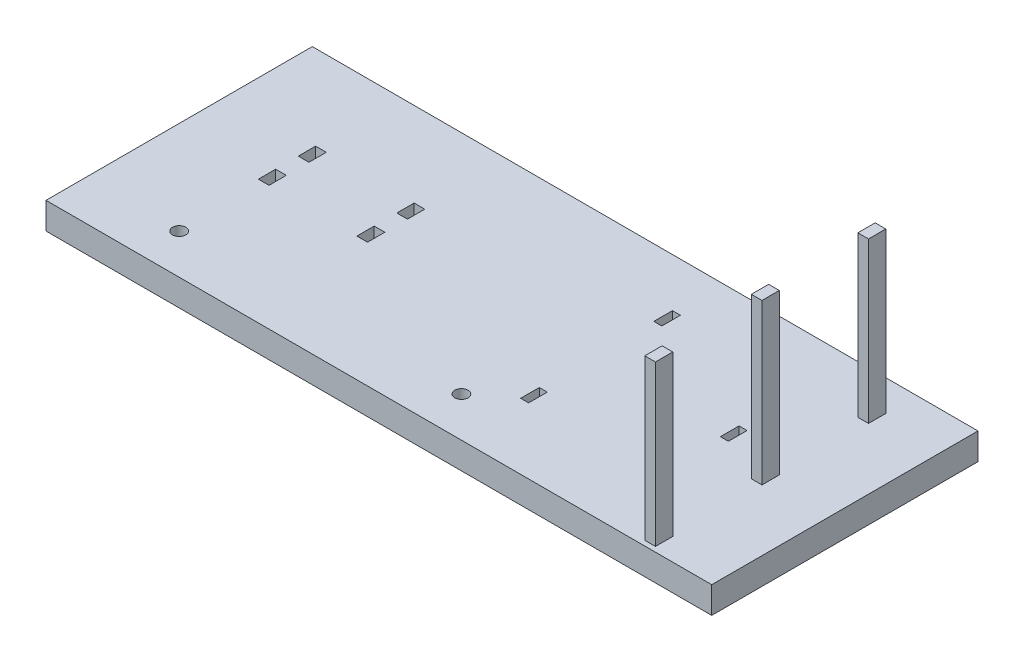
SolidWorks part; units mm, degrees
ref_plane "Front Plane" through (0, 0, 0) normal (0, 0, 1) x (1, 0, 0)
ref_plane "Top Plane" through (0, 0, 0) normal (0, 1, 0) x (1, 0, 0)
ref_plane "Right Plane" through (0, 0, 0) normal (1, 0, 0) x (0, 0, -1)
sketch "Sketch1" plane through (0, 0, 0) normal (0, 1, 0) x (1, 0, 0)
  line L1 (-12.5, -5) -> (12.5, -5)
  line L2 (-12.5, -5) -> (-12.5, 5)
  line L3 (-12.5, 5) -> (12.5, 5)
  line L4 (12.5, -5) -> (12.5, 5)
  line L5 (-12.5, -5) -> (12.5, 5) construction
  line L6 (-12.5, 5) -> (12.5, -5) construction
  point P0 (0, 0)
  dimension "D1" = 10
  dimension "D2" = 25
extrude "Boss-Extrude1" add sketch "Sketch1" along normal blind 1
sketch "Sketch2" plane through (0, 0, 0) normal (0, -1, 0) x (1, 0, 0)
  line L0 (-12.5, 0) -> (12.5, 0) construction
  line L1 (-9.2, -0.325) -> (-8.8, -0.325)
  line L2 (-9.2, -0.325) -> (-9.2, 0.325)
  line L3 (-9.2, 0.325) -> (-8.8, 0.325)
  line L4 (-8.8, -0.325) -> (-8.8, 0.325)
  line L5 (-9.2, -0.325) -> (-8.8, 0.325) construction
  line L6 (-9.2, 0.325) -> (-8.8, -0.325) construction
  line L7 (-9.2, -1.825) -> (-8.8, -1.825)
  line L8 (-9.2, -1.825) -> (-9.2, -1.175)
  line L9 (-9.2, -1.175) -> (-8.8, -1.175)
  line L10 (-8.8, -1.825) -> (-8.8, -1.175)
  line L11 (-9.2, -1.825) -> (-8.8, -1.175) construction
  line L12 (-9.2, -1.175) -> (-8.8, -1.825) construction
  line L13 (-12.5, -5) -> (-12.5, 5) construction
  line L14 (12.5, 5) -> (12.5, -5) construction
  line L15 (-5.5, 0.325) -> (-5.1, 0.325)
  line L16 (-5.5, -0.325) -> (-5.5, 0.325)
  line L17 (-5.5, -0.325) -> (-5.1, -0.325)
  line L18 (-5.1, -0.325) -> (-5.1, 0.325)
  line L19 (-5.5, -1.175) -> (-5.1, -1.175)
  line L20 (-5.5, -1.825) -> (-5.5, -1.175)
  line L21 (-5.5, -1.825) -> (-5.1, -1.825)
  line L22 (-5.1, -1.825) -> (-5.1, -1.175)
  line L24 (7.85, -0.675) -> (8.15, -0.675)
  line L25 (7.85, -0.675) -> (7.85, 0.025)
  line L26 (7.85, 0.025) -> (8.15, 0.025)
  line L27 (8.15, -0.675) -> (8.15, 0.025)
  line L28 (7.85, -0.675) -> (8.15, 0.025) construction
  line L29 (7.85, 0.025) -> (8.15, -0.675) construction
  line L30 (2.85, 1.825) -> (3.15, 1.825)
  line L31 (2.85, 1.825) -> (2.85, 2.525)
  line L32 (2.85, 2.525) -> (3.15, 2.525)
  line L33 (3.15, 1.825) -> (3.15, 2.525)
  line L34 (2.85, 1.825) -> (3.15, 2.525) construction
  line L35 (2.85, 2.525) -> (3.15, 1.825) construction
  line L36 (2.85, -2.475) -> (3.15, -2.475)
  line L37 (2.85, -2.475) -> (2.85, -3.175)
  line L38 (2.85, -3.175) -> (3.15, -3.175)
  line L39 (3.15, -2.475) -> (3.15, -3.175)
  line L40 (2.85, -2.475) -> (3.15, -3.175) construction
  line L41 (2.85, -3.175) -> (3.15, -2.475) construction
  circle A0 centre (-9, 3.5) radius 0.25
  circle A1 centre (1.6, 3.5) radius 0.25
  point P0 (-9, 0)
  point P5 (-9, -1.5)
  point P16 (-5.3, -1.5)
  point P19 (-5.3, 0)
  point P32 (8, -0.325)
  point P37 (3, 2.175)
  point P42 (3, -2.825)
  dimension "D11" = 3.5
  dimension "D12" = 0.5
  dimension "D1" = 0.4
  dimension "D2" = 0.65
  dimension "D3" = 0.65
  dimension "D4" = 0.4
  dimension "D5" = 0
  dimension "D6" = 1.5
  dimension "D7" = 9
  dimension "D8" = 9
  dimension "D13" = 10.6
  dimension "D14" = 3.5
  dimension "D15" = 0.7
  dimension "D16" = 0.3
  dimension "D17" = 0.7
  dimension "D18" = 0.3
  dimension "D19" = 0.7
  dimension "D20" = 0.3
  dimension "D21" = 2.5
  dimension "D22" = 5
  dimension "D23" = 2.5
  dimension "D24" = 5
  dimension "D25" = 3
  dimension "D26" = 0
  dimension "D9" = 2
  dimension "D10" = 2
extrude "Cut-Extrude1" cut sketch "Sketch2" against normal blind 1
sketch "Sketch3" plane through (0, 1, 0) normal (0, 1, 0) x (1, 0, 0)
  line L0 (9.8, -0.1626) -> (10.2, -0.1626)
  line L1 (9.8, 3.8374) -> (10.2, 3.8374)
  line L2 (9.8, 3.8374) -> (9.8, 3.1874)
  line L3 (9.8, 3.1874) -> (10.2, 3.1874)
  line L4 (10.2, 3.8374) -> (10.2, 3.1874)
  line L5 (9.8, 3.8374) -> (10.2, 3.1874) construction
  line L6 (9.8, 3.1874) -> (10.2, 3.8374) construction
  line L7 (9.8, -0.1626) -> (9.8, -0.8126)
  line L8 (9.8, -0.8126) -> (10.2, -0.8126)
  line L9 (10.2, -0.1626) -> (10.2, -0.8126)
  line L10 (9.8, -4.1626) -> (10.2, -4.1626)
  line L11 (9.8, -4.1626) -> (9.8, -4.8126)
  line L12 (9.8, -4.8126) -> (10.2, -4.8126)
  line L13 (10.2, -4.1626) -> (10.2, -4.8126)
  point P0 (10, 3.5124)
  point P8 (10, -0.4876)
  point P13 (10, -4.4876)
  dimension "D1" = 0.4
  dimension "D2" = 0.65
  dimension "D3" = 10
  dimension "D4" = 3
extrude "Boss-Extrude2" add sketch "Sketch3" along normal blind 6
